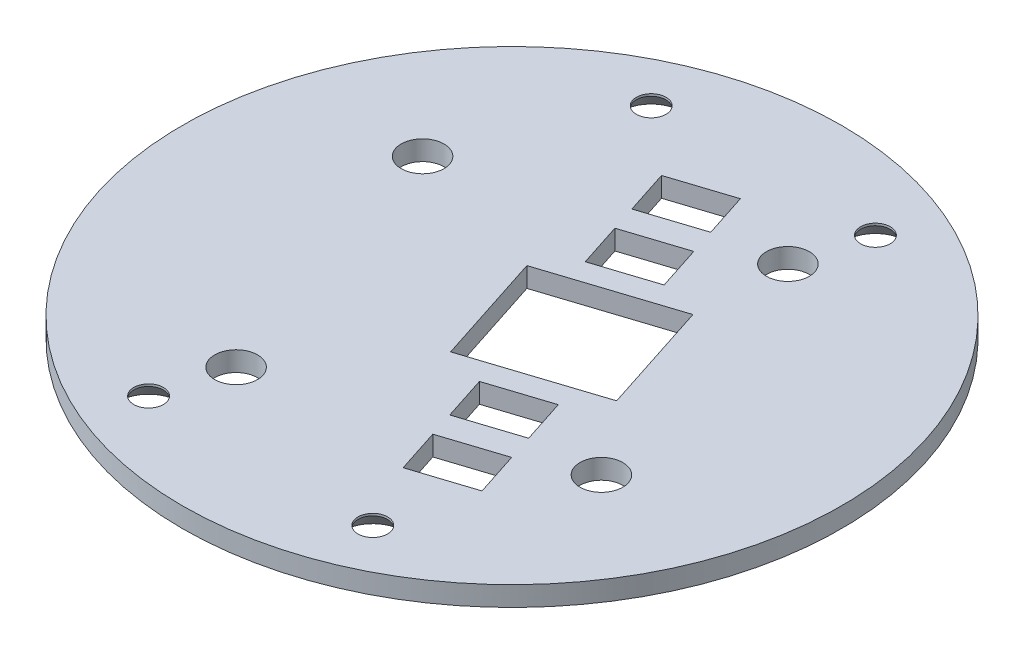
SolidWorks part; units mm, degrees
other "<a_base>-<Holes Pattern>"
ref_plane "Front Plane" through (0, 0, 0) normal (0, 0, 1) x (1, 0, 0)
ref_plane "Top Plane" through (0, 0, 0) normal (0, 1, 0) x (1, 0, 0)
ref_plane "Right Plane" through (0, 0, 0) normal (1, 0, 0) x (0, 0, -1)
inserted part "a_base"
sketch "Sketch1" plane through (0, 1.5, 0) normal (0, 1, 0) x (1, 0, 0)
  line L0 (-9.1667, -28.2843) -> (27.5, -28.2843) construction
  line L1 (-27.5, 28.2843) -> (9.1667, 28.2843) construction
  line L2 (9.1667, -28.2843) -> (-9.1667, 28.2843) construction
  line L3 (0, 0) -> (-44.7105, -14.4903) construction
  line L4 (6.6239, -20.4384) -> (23.2146, -15.0615) construction
  line L5 (27.5, -28.2843) -> (9.1667, 28.2843) construction
  line L6 (8.3379, -17.7805) -> (17.3752, -14.8516)
  line L7 (17.3752, -14.8516) -> (15.2171, -8.1926)
  line L8 (15.2171, -8.1926) -> (6.1798, -11.1215)
  line L9 (6.1798, -11.1215) -> (8.3379, -17.7805)
  line L10 (9.5712, -21.5857) -> (18.6084, -18.6568)
  line L11 (18.6084, -18.6568) -> (20.7665, -25.3158)
  line L12 (20.7665, -25.3158) -> (11.7293, -28.2447)
  line L13 (11.7293, -28.2447) -> (9.5712, -21.5857)
  line L14 (7.5187, 15.5611) -> (-1.5185, 12.6322)
  line L15 (5.3606, 22.2201) -> (7.5187, 15.5611)
  line L16 (-3.6766, 19.2912) -> (5.3606, 22.2201)
  line L17 (-1.5185, 12.6322) -> (-3.6766, 19.2912)
  line L18 (-4.9099, 23.0963) -> (4.1274, 26.0252)
  line L19 (4.1274, 26.0252) -> (1.9693, 32.6842)
  line L20 (1.9693, 32.6842) -> (-7.068, 29.7554)
  line L21 (-7.068, 29.7554) -> (-4.9099, 23.0963)
  circle A0 centre (0, 0) radius 47 construction
  circle A1 centre (-14.1457, -27.711) radius 3.25
  circle A2 centre (-27.711, 14.1457) radius 3.25
  circle A3 centre (14.1457, 27.711) radius 3.25
  circle A4 centre (27.711, -14.1457) radius 3.25
  point P27 (0, 0)
  dimension "D1" = 6.5
  dimension "D2" = 22
  dimension "D3" = 22
  dimension "D5" = 21.485
  dimension "D6" = 7
  dimension "D7" = 9.5
  dimension "D8" = 2
  dimension "D9" = 2.45
  dimension "D4" = 4
extrude "Base Pulley Cutout" cut sketch "Sketch1" against normal through all
sketch "Sketch2" plane through (0, 1.5, 0) normal (0, 1, 0) x (1, 0, 0)
  circle A0 centre (0, 0) radius 47 construction
  circle A1 centre (0, 0) radius 47
  circle A2 centre (0, 0) radius 50
  dimension "D1" = 100
extrude "Outer Ring" add sketch "Sketch2" against normal up to surface (3 mm away)
sketch "Sketch3" plane through (0, 1.5, 0) normal (0, 1, 0) x (1, 0, 0)
  circle A0 centre (-9.1667, -28.2843) radius 1 construction
  circle A1 centre (-27.5, 28.2843) radius 1 construction
  circle A2 centre (9.1667, 28.2843) radius 1 construction
  circle A3 centre (27.5, -28.2843) radius 1 construction
  circle A4 centre (-9.1667, -28.2843) radius 1
  circle A5 centre (-27.5, 28.2843) radius 1
  circle A6 centre (9.1667, 28.2843) radius 1
  circle A7 centre (27.5, -28.2843) radius 1
extrude "Patching" add sketch "Sketch3" against normal up to surface (3 mm away)
hole_wizard "CSK for #8 Flat Head Socket Cap Screw1" positions "Sketch7" profile "Sketch6" countersink size "#8" standard "ANSI Inch"
sketch "Sketch7" plane through (0, -1.5, 0) normal (0, -1, 0) x (-1, 0, 0)
  point P0 (-17.0093, -38.128)
  point P3 (17.0093, -38.128)
  point P6 (17.0093, 38.128)
  point P9 (-17.0093, 38.128)
sketch "Sketch6" plane through (17.0093, -1.5, 38.128) normal (1, 0, 0) x (0, 0, -1)
  line L0 (0, 0) -> (0, 3)
  line L1 (0, 3) -> (2.2479, 3)
  line L2 (2.2479, 3) -> (2.2479, 2.659)
  line L3 (2.2479, 2.659) -> (4.5593, 0)
  line L5 (4.5593, 0) -> (0, 0)
  line L6 (-2.2479, 2.659) -> (-4.5593, 0) construction
  line L11 (0, -6.35) -> (0, 107.95) construction
  dimension "Thru Hole Dia." = 4.4958
  dimension "Thru Hole Depth" = 3
  dimension "Near C'Sink Dia." = 9.1186
  dimension "Near C'Sink Angle" = 82
sketch "Sketch8" plane through (0, -1.5, 0) normal (0, -1, 0) x (1, 0, 0)
  line L0 (10.6984, 9.657) -> (3.0001, -14.0966) construction
  line L1 (15.2171, 8.1926) -> (6.1798, 11.1215) construction
  line L2 (-1.5185, -12.6322) -> (7.5187, -15.5611) construction
  line L3 (6.8493, -2.2198) -> (47.5644, -15.4152) construction
  line L4 (19.1369, 3.2588) -> (0.1111, 9.4248)
  line L5 (0.1111, 9.4248) -> (-5.4383, -7.6983)
  line L6 (-5.4383, -7.6983) -> (13.5874, -13.8644)
  line L7 (13.5874, -13.8644) -> (19.1369, 3.2588)
  circle A0 centre (0, 0) radius 50 construction
  dimension "D1" = 20
  dimension "D2" = 18
extrude "Wire Clearance" cut sketch "Sketch8" against normal through all
ref_point "Ref Center"
equation "\"D1@Sketch2\"=\"base diameter@values@params.sldprt\""
